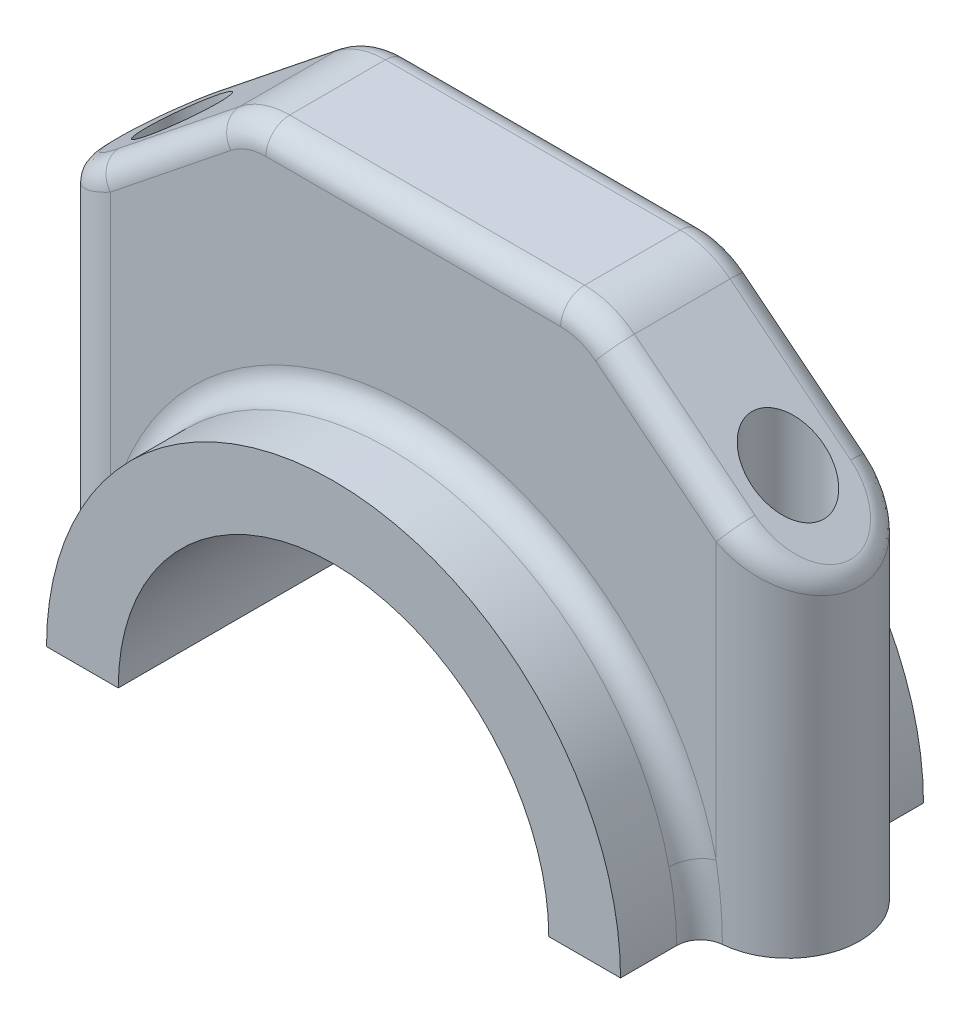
SolidWorks part; units mm, degrees
ref_plane "Front Plane" through (0, 0, 0) normal (0, 0, 1) x (1, 0, 0)
ref_plane "Top Plane" through (0, 0, 0) normal (0, 1, 0) x (1, 0, 0)
ref_plane "Right Plane" through (0, 0, 0) normal (1, 0, 0) x (0, 0, -1)
sketch "Sketch1" plane through (0, 0, 0) normal (0, 0, 1) x (1, 0, 0)
  line L0 (-36, 0) -> (-27, 0)
  line L1 (27, 0) -> (36, 0)
  arc A0 (27, 0) -> (-27, 0) centre (0, 0) ccw
  arc A1 (36, 0) -> (-36, 0) centre (0, 0) ccw
extrude "Boss-Extrude1" add sketch "Sketch1" along normal mid plane 38
ref_plane "Plane1" through (0, 60, 0) normal (0, -1, 0) x (-1, 0, 0)
sketch "Sketch2" plane through (0, 60, 0) normal (0, -1, 0) x (-1, 0, 0)
  line L0 (-38, 0) -> (38, 0) construction
  line L1 (-38, 9) -> (38, 9)
  line L2 (-38, -9) -> (38, -9)
  arc A0 (-38, 9) -> (-38, -9) centre (-38, 0) ccw
  arc A1 (38, -9) -> (38, 9) centre (38, 0) ccw
  point P2 (0, 0)
extrude "Boss-Extrude2" add sketch "Sketch2" along normal up to surface (60 mm away)
sketch "Sketch3" plane through (0, 0, 9) normal (0, 0, 1) x (1, 0, 0)
  line L1 (-27, 0) -> (27, 0)
  line L2 (-27, 0) -> (27, 0)
  arc A1 (27, 0) -> (-27, 0) centre (0, 0) ccw
  arc A2 (27, 0) -> (-27, 0) centre (0, 0) ccw
  dimension "D1" = 0
extrude "Cut-Extrude1" cut sketch "Sketch3" against normal through all
sketch "Sketch4" plane through (0, 60, 0) normal (0, -1, 0) x (-1, 0, 0)
  circle A0 centre (-38, 0) radius 4.5
  circle A1 centre (38, 0) radius 4.5
extrude "Cut-Extrude4" cut sketch "Sketch4" along normal through all
sketch "Sketch5" plane through (0, 0, 0) normal (0, 0, 1) x (1, 0, 0)
  line L0 (47, 40) -> (22, 60)
  line L1 (47, 0) -> (47, 60) construction
  line L2 (38, 60) -> (-38, 60) construction
  line L3 (0, 0) -> (0, 19.4184) construction
  line L4 (-47, 40) -> (-22, 60)
  line L5 (-22, 60) -> (-47, 60)
  line L6 (-11, 60) -> (11, 60) construction
  line L7 (-47, 60) -> (-47, 40)
  line L8 (22, 60) -> (47, 60)
  line L9 (47, 60) -> (47, 40)
  dimension "D1" = 25
  dimension "D2" = 20
extrude "Cut-Extrude5" cut sketch "Sketch5" against normal through all and the other way through all
fillet "Fillet1" radius 10 2 edges at (-22, 60, 0) (22, 60, 0)
fillet "Fillet2" radius 3 14 edges at (0, 36, 9) (0, 36, -9) (21.8023, 59.4363, 9) (31.3696, 52.5043, 9) (47, 40, 0) (31.3696, 52.5043, -9) (21.8023, 59.4363, -9) (0, 60, -9) (-21.8023, 59.4363, -9) (-31.3696, 52.5043, -9) (-47, 40, 0) (-31.3696, 52.5043, 9) (-21.8023, 59.4363, 9) (0, 60, 9)
